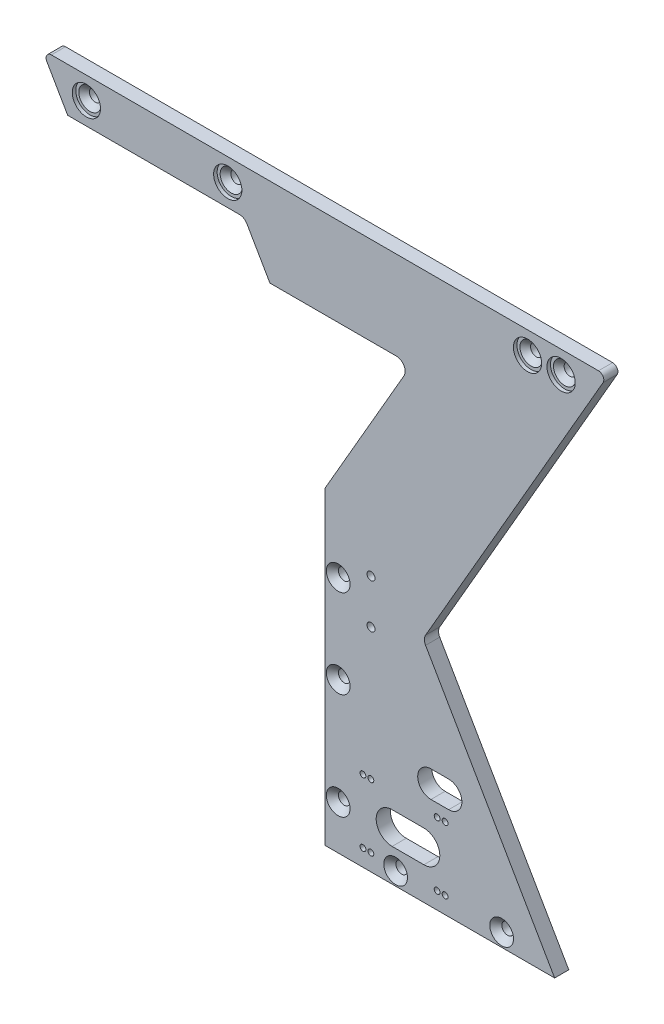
SolidWorks part; units mm, degrees
ref_plane "Front Plane" through (0, 0, 0) normal (0, 0, 1) x (1, 0, 0)
ref_plane "Top Plane" through (0, 0, 0) normal (0, 1, 0) x (1, 0, 0)
ref_plane "Right Plane" through (0, 0, 0) normal (1, 0, 0) x (0, 0, -1)
sketch "Sketch1" plane through (0, 0, 0) normal (0, 0, 1) x (1, 0, 0)
  line L0 (0, -155) -> (130, -155)
  line L1 (130, -155) -> (55.5107, -25.9808)
  line L2 (55.5107, -25.9808) -> (160, 155)
  line L3 (-31.1325, 105) -> (49.0748, 105)
  line L4 (49.0748, 105) -> (0, 20)
  line L5 (-31.1325, 105) -> (-45.5662, 130)
  line L6 (-45.5662, 130) -> (-145.5662, 130)
  line L7 (-145.5662, 130) -> (-160, 155)
  line L8 (160, 155) -> (-160, 155)
  line L9 (0, 155) -> (0, -155) construction
  line L10 (0, -155) -> (0, 20)
  dimension "D10" = 130
  dimension "D1" = 100
  dimension "D2" = 60
  dimension "D3" = 310
  dimension "D4" = 50
  dimension "D5" = 320
  dimension "D6" = 25
  dimension "D7" = 175
  dimension "D8" = 60
  dimension "D9" = 30
extrude "Boss-Extrude1" add sketch "Sketch1" along normal blind 8
hole_wizard "CSK for M6 SFHCS5" positions "Sketch15" profile "Sketch14" countersink size "M6" standard "ANSI Metric"
sketch "Sketch15" plane through (0, 0, 8) normal (0, 0, 1) x (1, 0, 0)
  line L0 (0, 20) -> (0, -155) construction
  line L1 (0, -155) -> (130, -155) construction
  point P0 (7.5, -70)
  point P2 (7.5, -130)
  dimension "D1" = 7.5
  dimension "D2" = 7.5
  dimension "D3" = 25
  dimension "D4" = 60
sketch "Sketch14" plane through (7.5, -70, 8) normal (1, 0, 0) x (0, -1, 0)
  line L0 (0, 0) -> (0, 8)
  line L1 (0, 8) -> (3.3, 8)
  line L2 (3.3, 8) -> (3.3, 3.42)
  line L3 (3.3, 3.42) -> (6.72, 0)
  line L5 (6.72, 0) -> (0, 0)
  line L6 (-3.3, 3.42) -> (-6.72, 0) construction
  line L11 (0, -6.35) -> (0, 107.95) construction
  dimension "Thru Hole Dia." = 6.6
  dimension "Thru Hole Depth" = 8
  dimension "Near C'Sink Dia." = 13.44
  dimension "Near C'Sink Angle" = 90
hole_wizard "CSK for M6 SFHCS7" positions "Sketch19" profile "Sketch18" countersink size "M6" standard "ANSI Metric"
sketch "Sketch19" plane through (0, 0, 8) normal (0, 0, 1) x (1, 0, 0)
  line L0 (0, 20) -> (0, -155) construction
  line L1 (0, -155) -> (130, -155) construction
  point P0 (7.5, -20)
  point P2 (40, -147.5)
  point P4 (100, -147.5)
  dimension "D1" = 7.5
  dimension "D2" = 135
  dimension "D3" = 7.5
  dimension "D4" = 7.5
  dimension "D5" = 40
  dimension "D6" = 100
sketch "Sketch18" plane through (7.5, -20, 8) normal (1, 0, 0) x (0, -1, 0)
  line L0 (0, 0) -> (0, 8)
  line L1 (0, 8) -> (3.3, 8)
  line L2 (3.3, 8) -> (3.3, 3.42)
  line L3 (3.3, 3.42) -> (6.72, 0)
  line L5 (6.72, 0) -> (0, 0)
  line L6 (-3.3, 3.42) -> (-6.72, 0) construction
  line L11 (0, -6.35) -> (0, 107.95) construction
  dimension "Thru Hole Dia." = 6.6
  dimension "Thru Hole Depth" = 8
  dimension "Near C'Sink Dia." = 13.44
  dimension "Near C'Sink Angle" = 90
hole_wizard "CSK for M6 SFHCS8" positions "Sketch26" profile "Sketch25" countersink size "M6" standard "ANSI Metric"
sketch "Sketch26" plane through (0, 0, 0) normal (0, 0, -1) x (-1, 0, 0)
  line L2 (-100, -147.5) -> (-40, -147.5) construction
  line L3 (-7.5, -20) -> (-7.5, -70) construction
  line L4 (-7.5, -70) -> (-7.5, -130) construction
  line L6 (0, 20) -> (0, -155) construction
  line L7 (0, -155) -> (-130, -155) construction
  point P0 (-100, -147.5)
  point P2 (-40, -147.5)
  point P4 (-7.5, -130)
  point P6 (-7.5, -70)
  point P8 (-7.5, -20)
  dimension "D1" = 7.5
  dimension "D2" = 7.5
  dimension "D3" = 40
  dimension "D4" = 100
  dimension "D5" = 25
  dimension "D6" = 85
  dimension "D7" = 135
sketch "Sketch25" plane through (100, -147.5, 0) normal (1, 0, 0) x (0, 1, 0)
  line L0 (0, 0) -> (0, 8)
  line L1 (0, 8) -> (3.3, 8)
  line L2 (3.3, 8) -> (3.3, 3.42)
  line L3 (3.3, 3.42) -> (6.72, 0)
  line L5 (6.72, 0) -> (0, 0)
  line L6 (-3.3, 3.42) -> (-6.72, 0) construction
  line L11 (0, -6.35) -> (0, 107.95) construction
  dimension "Thru Hole Dia." = 6.6
  dimension "Thru Hole Depth" = 8
  dimension "Near C'Sink Dia." = 13.44
  dimension "Near C'Sink Angle" = 90
fillet "Fillet2" radius 3 2 edges at (160, 155, 4) (-160, 155, 4)
fillet "Fillet3" radius 5 3 edges at (-45.5662, 130, 4) (49.0748, 105, 4) (55.5107, -25.9808, 4)
sketch "Sketch29" plane through (0, 0, 0) normal (0, 0, -1) x (-1, 0, 0)
  line L2 (-60, -95) -> (-70, -95) construction
  line L3 (-60, -102.5) -> (-70, -102.5)
  line L4 (-60, -87.5) -> (-70, -87.5)
  line L5 (0, 20) -> (0, -155) construction
  line L6 (0, -155) -> (-130, -155) construction
  arc A0 (-60, -102.5) -> (-60, -87.5) centre (-60, -95) ccw
  arc A1 (-70, -87.5) -> (-70, -102.5) centre (-70, -95) ccw
  point P2 (-65, -95)
  dimension "D3" = 7.5
  dimension "D1" = 65
  dimension "D2" = 60
  dimension "D4" = 10
extrude "Cut-Extrude2" cut sketch "Sketch29" against normal through all
sketch "Sketch44" plane through (0, 0, 8) normal (0, 0, 1) x (1, 0, 0)
  line L0 (-147.9378, 151.5) -> (147.9378, 151.5)
  line L1 (149.6699, 148.5) -> (141.587, 134.5)
  line L2 (139.8549, 133.5) -> (-139.8549, 133.5)
  line L3 (-141.587, 134.5) -> (-149.6699, 148.5)
  line L5 (154.8038, 155) -> (-154.8038, 155) construction
  arc A0 (157.4019, 150.5) -> (154.8038, 155) centre (154.8038, 152) ccw construction
  arc A4 (-154.8038, 155) -> (-157.4019, 150.5) centre (-154.8038, 152) ccw construction
  arc A5 (-147.9378, 151.5) -> (-149.6699, 148.5) centre (-147.9378, 149.5) ccw
  arc A6 (-141.587, 134.5) -> (-139.8549, 133.5) centre (-139.8549, 135.5) ccw
  arc A7 (139.8549, 133.5) -> (141.587, 134.5) centre (139.8549, 135.5) ccw
  arc A8 (149.6699, 148.5) -> (147.9378, 151.5) centre (147.9378, 149.5) ccw
  point P10 (-157.4019, 153.5)
  point P16 (-151.4019, 151.5)
  point P23 (151.4019, 151.5)
  point P27 (157.4019, 153.5)
  dimension "D2" = 3.5
  dimension "D7" = 2
  dimension "D1" = 18
  dimension "D3" = 300
  dimension "D4" = 60
  dimension "D5" = 6
  dimension "D6" = 6
extrude "Cut-Extrude3" [suppressed] cut sketch "Sketch44" against normal blind 1
hole_wizard "CSK for M6 SFHCS12" positions "Sketch46" profile "Sketch45" countersink size "M6" standard "ANSI Metric"
sketch "Sketch46" [suppressed] plane through (0, 0, 7) normal (0, 0, 1) x (1, 0, 0)
  point P0 (-54.9965, 142.5)
  point P3 (-129.9965, 142.5)
  point P6 (114.6491, 142.5)
  point P9 (133.6491, 142.5)
sketch "Sketch45" plane through (-54.9965, 142.5, 7) normal (1, 0, 0) x (0, -1, 0)
  line L0 (0, 0) -> (0, 7)
  line L1 (0, 7) -> (3.3, 7)
  line L2 (3.3, 7) -> (3.3, 3.42)
  line L3 (3.3, 3.42) -> (6.72, 0)
  line L5 (6.72, 0) -> (0, 0)
  line L6 (-3.3, 3.42) -> (-6.72, 0) construction
  line L11 (0, -6.35) -> (0, 107.95) construction
  dimension "Thru Hole Dia." = 6.6
  dimension "Thru Hole Depth" = 7
  dimension "Near C'Sink Dia." = 13.44
  dimension "Near C'Sink Angle" = 90
sketch "Sketch47" [suppressed] plane through (0, 0, 0) normal (0, 0, -1) x (-1, 0, 0)
  line L0 (-147.9378, 151.5) -> (147.9378, 151.5)
  line L1 (149.6699, 148.5) -> (141.587, 134.5)
  line L2 (139.8549, 133.5) -> (-139.8549, 133.5)
  line L3 (-141.587, 134.5) -> (-149.6699, 148.5)
  line L5 (-154.8038, 155) -> (154.8038, 155) construction
  arc A0 (-154.8038, 155) -> (-157.4019, 150.5) centre (-154.8038, 152) ccw construction
  arc A3 (157.4019, 150.5) -> (154.8038, 155) centre (154.8038, 152) ccw construction
  arc A4 (149.6699, 148.5) -> (147.9378, 151.5) centre (147.9378, 149.5) ccw
  arc A5 (141.587, 134.5) -> (139.8549, 133.5) centre (139.8549, 135.5) cw
  arc A6 (-139.8549, 133.5) -> (-141.587, 134.5) centre (-139.8549, 135.5) cw
  arc A7 (-149.6699, 148.5) -> (-147.9378, 151.5) centre (-147.9378, 149.5) cw
  point P13 (-157.4019, 153.5)
  point P16 (151.4019, 151.5)
  point P17 (157.4019, 153.5)
  point P27 (-151.4019, 151.5)
  dimension "D5" = 6
  dimension "D7" = 2
  dimension "D1" = 18
  dimension "D2" = 3.5
  dimension "D3" = 60
  dimension "D4" = 6
  dimension "D6" = 60
extrude "Cut-Extrude4" [suppressed] cut sketch "Sketch47" against normal blind 1
hole_wizard "CSK for M6 SFHCS13" positions "Sketch49" profile "Sketch48" countersink size "M6" standard "ANSI Metric"
sketch "Sketch49" plane through (0, 0, 1) normal (0, 0, -1) x (-1, 0, 0)
  point P0 (-114.6491, 142.5)
  point P3 (-133.6491, 142.5)
  point P6 (54.9965, 142.5)
  point P9 (129.9965, 142.5)
sketch "Sketch48" plane through (116, 142.5, 1) normal (1, 0, 0) x (0, 1, 0)
  line L0 (0, 0) -> (0, 7)
  line L1 (0, 7) -> (3.3, 7)
  line L2 (3.3, 7) -> (3.3, 3.42)
  line L3 (3.3, 3.42) -> (6.72, 0)
  line L5 (6.72, 0) -> (0, 0)
  line L6 (-3.3, 3.42) -> (-6.72, 0) construction
  line L11 (0, -6.35) -> (0, 107.95) construction
  dimension "Thru Hole Dia." = 6.6
  dimension "Thru Hole Depth" = 7
  dimension "Near C'Sink Dia." = 13.44
  dimension "Near C'Sink Angle" = 90
hole_wizard "M3x0.5 Tapped Hole1" positions "Sketch69" profile "Sketch68" tap size "M3x0.5" standard "ANSI Metric"
sketch "Sketch69" plane through (0, 0, 8) normal (0, 0, 1) x (1, 0, 0)
  point P0 (4.5035, 115)
  point P3 (20.5035, 115)
sketch "Sketch68" plane through (4.5035, 115, 8) normal (1, 0, 0) x (0, -1, 0)
  line L0 (0, 0) -> (0, 7.7511)
  line L1 (0, 7.7511) -> (1.25, 7)
  line L2 (1.25, 7) -> (1.25, 0)
  line L5 (1.25, 0) -> (0, 0)
  line L10 (0, 7.7511) -> (-1.25, 7) construction
  line L11 (0, -6.35) -> (0, 107.95) construction
  dimension "Tap Drill Dia." = 2.5
  dimension "Tap Drill Depth" = 7
  dimension "Drill Angle" = 118
hole_wizard "M3x0.5 Tapped Hole2" positions "Sketch71" profile "Sketch70" tap size "M3x0.5" standard "ANSI Metric"
sketch "Sketch71" plane through (0, 0, 0) normal (0, 0, -1) x (-1, 0, 0)
  point P0 (-20.5035, 115)
  point P3 (-4.5035, 115)
sketch "Sketch70" plane through (20.5035, 115, 0) normal (1, 0, 0) x (0, 1, 0)
  line L0 (0, 0) -> (0, 7.7511)
  line L1 (0, 7.7511) -> (1.25, 7)
  line L2 (1.25, 7) -> (1.25, 0)
  line L5 (1.25, 0) -> (0, 0)
  line L10 (0, 7.7511) -> (-1.25, 7) construction
  line L11 (0, -6.35) -> (0, 107.95) construction
  dimension "Tap Drill Dia." = 2.5
  dimension "Tap Drill Depth" = 7
  dimension "Drill Angle" = 118
sketch "Sketch72" plane through (0, 0, 8) normal (0, 0, 1) x (1, 0, 0)
  circle A0 centre (-134.9965, 142.5) radius 8
  circle A1 centre (-54.9965, 142.5) radius 8
  dimension "D1" = 16
  dimension "D2" = 16
extrude "Cut-Extrude5" cut sketch "Sketch72" against normal blind 2
sketch "Sketch73" plane through (0, 0, 8) normal (0, 0, 1) x (1, 0, 0)
  circle A0 centre (114.6491, 142.5) radius 8
  circle A1 centre (133.6491, 142.5) radius 8
  dimension "D1" = 16
  dimension "D2" = 16
extrude "Cut-Extrude6" cut sketch "Sketch73" against normal blind 2
hole_wizard "CSK for M6 Flat Head Machine Screw4" positions "Sketch77" profile "Sketch76" countersink size "M6" standard "ANSI Metric"
sketch "Sketch77" plane through (0, 0, 6) normal (0, 0, 1) x (1, 0, 0)
  point P0 (-134.9965, 142.5)
  point P3 (-54.9965, 142.5)
  point P6 (114.6491, 142.5)
  point P9 (133.6491, 142.5)
sketch "Sketch76" plane through (-134.9965, 142.5, 6) normal (1, 0, 0) x (0, -1, 0)
  line L0 (0, 0) -> (0, 6)
  line L1 (0, 6) -> (3.3, 6)
  line L2 (3.3, 6) -> (3.3, 3)
  line L3 (3.3, 3) -> (6.3, 0)
  line L5 (6.3, 0) -> (0, 0)
  line L6 (-3.3, 3) -> (-6.3, 0) construction
  line L11 (0, -6.35) -> (0, 107.95) construction
  dimension "Thru Hole Dia." = 6.6
  dimension "Thru Hole Depth" = 6
  dimension "Near C'Sink Dia." = 12.6
  dimension "Near C'Sink Angle" = 90
sketch "Sketch80" [suppressed] plane through (0, 0, 0) normal (0, 0, -1) x (-1, 0, 0)
  circle A0 centre (-114.6491, 142.5) radius 8
  circle A1 centre (-133.6491, 142.5) radius 8
  dimension "D1" = 16
  dimension "D2" = 16
extrude "Cut-Extrude7" [suppressed] cut sketch "Sketch80" against normal blind 2
sketch "Sketch81" [suppressed] plane through (0, 0, 0) normal (0, 0, -1) x (-1, 0, 0)
  circle A0 centre (54.9965, 142.5) radius 8
  circle A1 centre (134.9965, 142.5) radius 8
  dimension "D1" = 16
  dimension "D2" = 16
extrude "Cut-Extrude8" [suppressed] cut sketch "Sketch81" against normal blind 2
hole_wizard "CSK for M6 Flat Head Machine Screw5" positions "Sketch83" profile "Sketch82" countersink size "M6" standard "ANSI Metric"
sketch "Sketch83" plane through (0, 0, 2) normal (0, 0, -1) x (-1, 0, 0)
  point P0 (-133.6491, 142.5)
  point P3 (-114.6491, 142.5)
  point P6 (54.9965, 142.5)
  point P9 (134.9965, 142.5)
sketch "Sketch82" plane through (133.6491, 142.5, 2) normal (1, 0, 0) x (0, 1, 0)
  line L0 (0, 0) -> (0, 6)
  line L1 (0, 6) -> (3.3, 6)
  line L2 (3.3, 6) -> (3.3, 3)
  line L3 (3.3, 3) -> (6.3, 0)
  line L5 (6.3, 0) -> (0, 0)
  line L6 (-3.3, 3) -> (-6.3, 0) construction
  line L11 (0, -6.35) -> (0, 107.95) construction
  dimension "Thru Hole Dia." = 6.6
  dimension "Thru Hole Depth" = 6
  dimension "Near C'Sink Dia." = 12.6
  dimension "Near C'Sink Angle" = 90
sketch "Sketch84" [suppressed] plane through (0, 0, 0) normal (0, 0, -1) x (-1, 0, 0)
  line L0 (-63.3978, 145.7) -> (-58.8978, 145.7) construction
  line L1 (-65.3978, 146.2) -> (-49.9978, 146.2)
  line L2 (-65.3978, 146.2) -> (-65.3978, 138.2)
  line L3 (-65.3978, 138.2) -> (-49.9978, 138.2)
  line L4 (-49.9978, 146.2) -> (-49.9978, 138.2)
  line L5 (-58.8978, 138.7) -> (-63.3978, 138.7) construction
  line L6 (-50.4978, 140.4) -> (-50.4978, 144) construction
  line L7 (-64.8978, 140.4) -> (-64.8978, 144) construction
  dimension "D1" = 0.5
  dimension "D2" = 0.5
  dimension "D3" = 0.5
  dimension "D4" = 0.5
extrude "Cut-Extrude9" [suppressed] cut sketch "Sketch84" against normal through all
fillet "Fillet4" [suppressed] radius 1.5
hole_wizard "M3x0.5 Tapped Hole3" positions "Sketch86" profile "Sketch85" tap size "M3x0.5" standard "ANSI Metric"
sketch "Sketch86" plane through (0, 0, 8) normal (0, 0, 1) x (1, 0, 0)
  line L0 (22.4028, 29) -> (70.4028, 29) construction
  point P0 (45.0978, 146)
  point P3 (97.0978, 146)
  point P6 (61.0978, 119)
  point P9 (123.0978, 121)
  point P12 (70.4028, 29)
  point P15 (22.4028, 29)
  dimension "D1" = 48
sketch "Sketch85" plane through (45.0978, 146, 8) normal (1, 0, 0) x (0, -1, 0)
  line L0 (0, 0) -> (0, 6.7511)
  line L1 (0, 6.7511) -> (1.25, 6)
  line L2 (1.25, 6) -> (1.25, 0)
  line L5 (1.25, 0) -> (0, 0)
  line L10 (0, 6.7511) -> (-1.25, 6) construction
  line L11 (0, -6.35) -> (0, 107.95) construction
  dimension "Tap Drill Dia." = 2.5
  dimension "Tap Drill Depth" = 6
  dimension "Drill Angle" = 118
hole_wizard "Ø4.5 (4.5) Diameter Hole1" positions "Sketch88" profile "Sketch87" hole size "Ø4.5" standard "ANSI Metric"
sketch "Sketch88" plane through (0, 0, 8) normal (0, 0, 1) x (1, 0, 0)
  point P0 (26.077, -10)
  point P3 (26.077, -35)
sketch "Sketch87" plane through (26.077, -10, 8) normal (1, 0, 0) x (0, -1, 0)
  line L0 (0, 0) -> (0, 8)
  line L1 (0, 8) -> (2.25, 8)
  line L2 (2.25, 8) -> (2.25, 0)
  line L5 (2.25, 0) -> (0, 0)
  line L11 (0, -6.35) -> (0, 107.95) construction
  dimension "Thru Hole Dia." = 4.5
  dimension "Thru Hole Depth" = 8
sketch "Sketch89" plane through (0, 0, 8) normal (0, 0, 1) x (1, 0, 0)
  line L0 (38, -127.5) -> (56, -127.5) construction
  line L1 (38, -118.5) -> (56, -118.5)
  line L2 (38, -136.5) -> (56, -136.5)
  arc A0 (38, -118.5) -> (38, -136.5) centre (38, -127.5) ccw
  arc A1 (56, -136.5) -> (56, -118.5) centre (56, -127.5) ccw
  point P2 (47, -127.5)
  dimension "D1" = 9
  dimension "D2" = 18
extrude "Cut-Extrude10" cut sketch "Sketch89" against normal through all
hole_wizard "M4x0.7 Tapped Hole1" positions "Sketch92" profile "Sketch91" tap size "M4x0.7" standard "ANSI Metric"
sketch "Sketch92" plane through (0, 0, 8) normal (0, 0, 1) x (1, 0, 0)
  line L0 (20.05, -109.5) -> (73.95, -109.5) construction
  line L2 (20.05, -145.5) -> (73.95, -145.5) construction
  line L4 (26, -107.3) -> (26, -147.7) construction
  line L5 (22.25, -107.3) -> (29.75, -107.3) construction
  line L6 (29.75, -147.7) -> (22.25, -147.7) construction
  line L8 (68, -107.3) -> (68, -147.7) construction
  line L9 (64.25, -107.3) -> (71.75, -107.3) construction
  line L10 (71.75, -147.7) -> (64.25, -147.7) construction
  arc A0 (22.25, -107.3) -> (22.25, -111.7) centre (22.25, -109.5) ccw construction
  arc A1 (71.75, -111.7) -> (71.75, -107.3) centre (71.75, -109.5) ccw construction
  arc A2 (22.25, -143.3) -> (22.25, -147.7) centre (22.25, -145.5) ccw construction
  arc A3 (71.75, -147.7) -> (71.75, -143.3) centre (71.75, -145.5) ccw construction
  point P39 (26, -145.5)
  point P45 (26, -109.5)
  point P47 (68, -109.5)
  point P49 (68, -145.5)
sketch "Sketch91" plane through (26, -145.5, 8) normal (1, 0, 0) x (0, -1, 0)
  line L0 (0, 0) -> (0, 8)
  line L1 (0, 8) -> (1.65, 8)
  line L2 (1.65, 8) -> (1.65, 0)
  line L5 (1.65, 0) -> (0, 0)
  line L11 (0, -6.35) -> (0, 107.95) construction
  dimension "Thru Tap Drill Dia." = 3.3
  dimension "Thru Tap Drill Depth" = 8
hole_wizard "M3x0.5 Tapped Hole4" positions "Sketch95" profile "Sketch94" tap size "M3x0.5" standard "ANSI Metric"
sketch "Sketch95" plane through (0, 0, 0) normal (0, 0, -1) x (-1, 0, 0)
  point P0 (-123.0978, 121)
  point P3 (-97.0978, 146)
  point P6 (-45.0978, 146)
  point P9 (-61.0978, 119)
  point P12 (-22.4028, 29)
  point P15 (-70.4028, 29)
sketch "Sketch94" plane through (123.0978, 121, 0) normal (1, 0, 0) x (0, 1, 0)
  line L0 (0, 0) -> (0, 6.7511)
  line L1 (0, 6.7511) -> (1.25, 6)
  line L2 (1.25, 6) -> (1.25, 0)
  line L5 (1.25, 0) -> (0, 0)
  line L10 (0, 6.7511) -> (-1.25, 6) construction
  line L11 (0, -6.35) -> (0, 107.95) construction
  dimension "Tap Drill Dia." = 2.5
  dimension "Tap Drill Depth" = 6
  dimension "Drill Angle" = 118
pattern_linear "LPattern1" count 2 spacing 4.5 along (-1, 0, 0) of "M4x0.7 Tapped Hole1"
